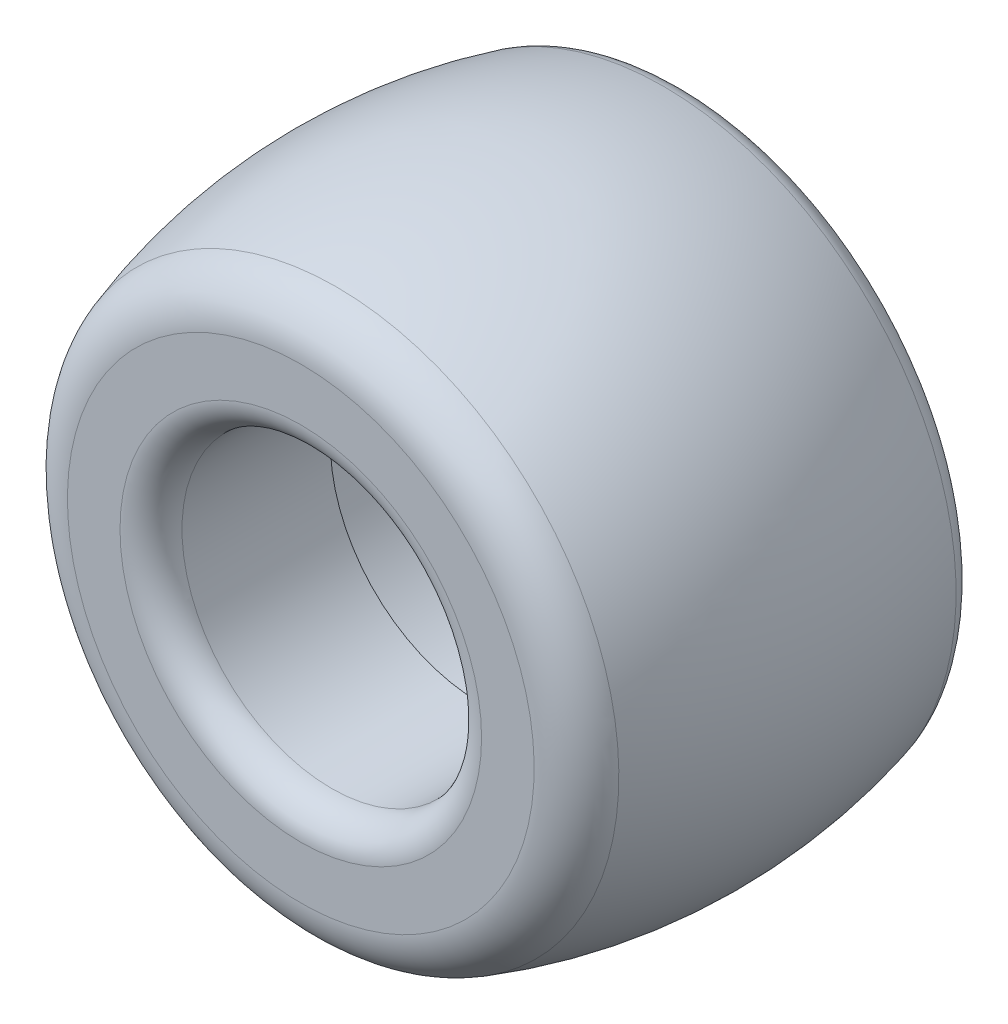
SolidWorks part; units mm, degrees
ref_plane "Plan de face" through (0, 0, 0) normal (0, 0, 1) x (1, 0, 0)
ref_plane "Plan de dessus" through (0, 0, 0) normal (0, 1, 0) x (1, 0, 0)
ref_plane "Plan de droite" through (0, 0, 0) normal (1, 0, 0) x (0, 0, -1)
ref_plane "Plan4" through (0, 509.3952, 0) normal (0, -1, 0) x (1, 0, 0)
sketch "Esquisse1" plane through (0, 509.3952, 0) normal (0, -1, 0) x (1, 0, 0)
  line L0 (-1701.7957, -887.0356) -> (-1698.7957, -887.0356)
  line L1 (-1698.7957, -887.0356) -> (-1698.7957, -900.3687)
  line L2 (-1698.7957, -900.3687) -> (-1693.0074, -906.157)
  line L3 (-1693.7057, -869.6707) -> (-1698.7957, -869.6707)
  line L4 (-1701.7957, -872.6707) -> (-1701.7957, -887.0356)
  line L5 (-1716.2957, -869.6707) -> (-1716.2957, -907.0356) construction
  arc A0 (-1693.0074, -906.157) -> (-1687.983, -904.792) centre (-1690.8861, -904.0356) ccw
  arc A1 (-1687.983, -904.792) -> (-1688.9534, -873.1163) centre (-1742.4272, -890.6072) ccw
  arc A2 (-1688.9534, -873.1163) -> (-1693.7057, -869.6707) centre (-1693.7057, -874.6707) ccw
  arc A3 (-1698.7957, -869.6707) -> (-1701.7957, -872.6707) centre (-1698.7957, -872.6707) ccw
revolve "Révolution1" add sketch "Esquisse1" angle 360 about L5
